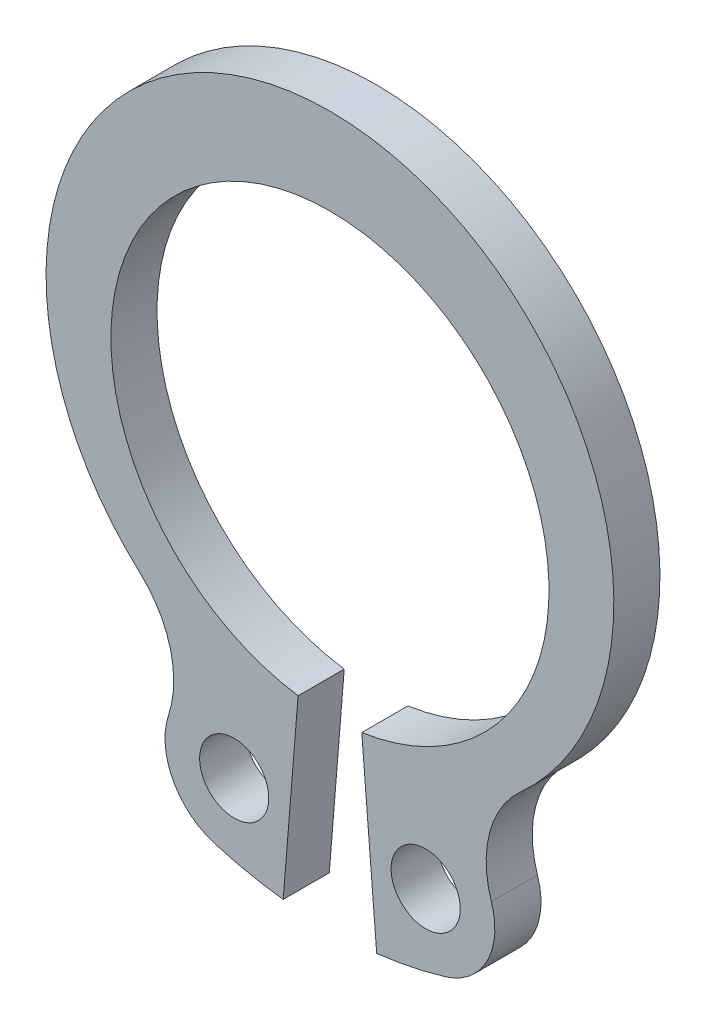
SolidWorks part; units mm, degrees
ref_plane "Face" through (0, 0, 0) normal (0, 0, 1) x (1, 0, 0)
ref_plane "Dessus" through (0, 0, 0) normal (0, 1, 0) x (1, 0, 0)
ref_plane "Droite" through (0, 0, 0) normal (1, 0, 0) x (0, 0, -1)
sketch "Esquisse1" plane through (0, 0, 0) normal (0, 0, 1) x (1, 0, 0)
  line L0 (0, 5.3) -> (0, 3.8) construction
  line L1 (0.5524, -3.7596) -> (0.8112, -6.9492)
  line L2 (-0.5524, -3.7596) -> (-0.8112, -6.9492)
  line L3 (0.24, -3.6922) -> (0.24, -6.8922) construction
  line L4 (-0.24, -3.6922) -> (-0.24, -6.8922) construction
  arc A0 (0.5524, -3.7596) -> (-0.5524, -3.7596) centre (0, 0) ccw
  arc A1 (3.3029, -3.2783) -> (-3.3029, -3.2783) centre (0, 0.375) ccw
  arc A2 (0.8112, -6.9492) -> (2.0049, -6.7029) centre (0, 0) ccw
  circle A3 centre (1.6611, -5.5532) radius 0.6
  arc A4 (2.0049, -6.7029) -> (2.8007, -5.1773) centre (1.6611, -5.5532) ccw
  arc A5 (3.3029, -3.2783) -> (2.8007, -5.1773) centre (4.5101, -4.6135) ccw
  circle A6 centre (-1.6611, -5.5532) radius 0.6
  arc A7 (-3.3029, -3.2783) -> (-2.8007, -5.1773) centre (-4.5101, -4.6135) cw
  arc A8 (-2.0049, -6.7029) -> (-2.8007, -5.1773) centre (-1.6611, -5.5532) cw
  arc A9 (-0.8112, -6.9492) -> (-2.0049, -6.7029) centre (0, 0) cw
  arc A10 (0.24, -3.6922) -> (-0.24, -3.6922) centre (0, 0) ccw construction
  circle A11 centre (0, 0) radius 4 construction
  dimension "dgorge" = 7.6
  dimension "D3" = 0.375
  dimension "dtrou" = 1.2
  dimension "D8" = 1.2
  dimension "D9" = 1.8
  dimension "dint" = 7.4
  dimension "dn" = 8
  dimension "b" = 1.5
  dimension "a" = 3.2
  dimension "D5" = 16.716
  dimension "D7" = 0.96
  dimension "D12" = 0.48
  dimension "D13" = 7.438
  dimension "D14" = 4.639
extrude "Base-Extrusion" add sketch "Esquisse1" along normal blind 0.8
equation "\"D3@Esquisse1\" = \"b@Esquisse1\"/4"
equation "\"D7@Esquisse1\"=\"dtrou@Esquisse1\"*0.8"
equation "\"D8@Esquisse1\" = \"dtrou@Esquisse1\""
equation "\"D9@Esquisse1\" = \"dtrou@Esquisse1\"*1.5"
equation "\"D12@Esquisse1\" = \"dtrou@Esquisse1\"*0.4"
equation "\"D5@Esquisse1\" = 360-(360-\"D13@Esquisse1\")*\"dint@Esquisse1\"/\"dgorge@Esquisse1\""
equation "\"D14@Esquisse1\" = (\"D5@Esquisse1\"-\"D13@Esquisse1\")/2"
